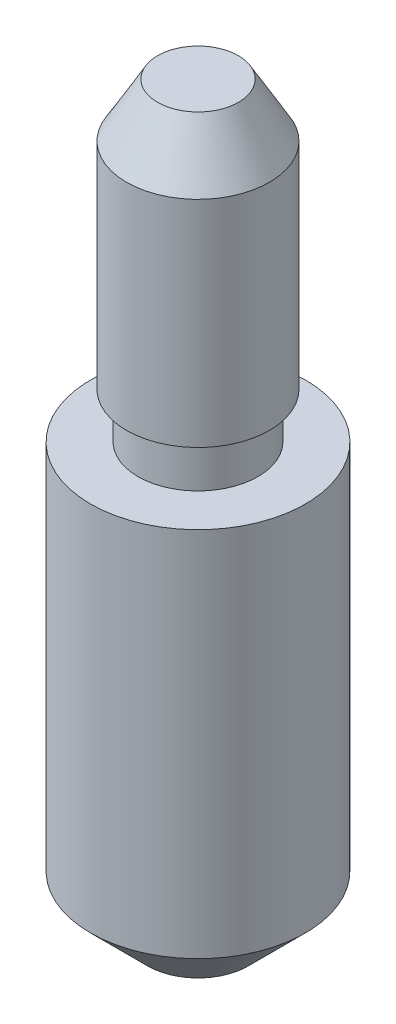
SolidWorks part; units mm, degrees
ref_plane "Front" through (0, 0, 0) normal (0, 0, 1) x (1, 0, 0)
ref_plane "Top" through (0, 0, 0) normal (0, 1, 0) x (1, 0, 0)
ref_plane "Right" through (0, 0, 0) normal (1, 0, 0) x (0, 0, -1)
sketch "Sketch1" plane through (0, 0, 0) normal (1, 0, 0) x (0, 0, -1)
  line L0 (0, 5.5025) -> (0, -11.5809) construction
  line L1 (0, -9.525) -> (2.3876, -9.525)
  line L2 (2.3876, -9.525) -> (2.3876, 0)
  line L3 (2.3876, 0) -> (1.3335, 0)
  line L4 (1.3335, 0) -> (1.3335, 1.016)
  line L5 (1.3335, 1.016) -> (1.5875, 1.016)
  line L6 (1.5875, 1.016) -> (1.5875, 5.7912)
  line L7 (0.8983, 6.985) -> (0, 6.985)
  line L8 (0, 6.985) -> (0, -9.525)
  line L9 (0.8983, 6.985) -> (1.5875, 5.7912)
  dimension "D1" = 4.7752
  dimension "D2" = 9.525
  dimension "D3" = 1.016
  dimension "D4" = 0.254
  dimension "D5" = 3.175
  dimension "D6" = 4.7752
  dimension "D7" = 1.1938
  dimension "D8" = 30
revolve "Revolve1" add sketch "Sketch1" angle 360 about L0
chamfer "Chamfer1" distance 1.27 angle 45 1 edges at (0, -9.525, 2.3876)
sketch "Sketch2" [suppressed] plane through (0, 0, 0) normal (0, 1, 0) x (-1, 0, 0)
  line L0 (-2.3876, 0) -> (0, 1.717)
  line L1 (0, 1.717) -> (2.3876, 0)
  line L2 (2.3876, 0) -> (-2.3876, 0) construction
  line L3 (2.3876, 0) -> (2.3876, 2.5866)
  line L4 (2.3876, 2.5866) -> (-2.3876, 2.5866)
  line L5 (-2.3876, 2.5866) -> (-2.3876, 0)
  circle A0 centre (0, 0) radius 2.3876 construction
  point P3 (0, 0)
extrude "Cut-Extrude3" [suppressed] cut sketch "Sketch2" along normal blind 9.906
mirror "Mirror1" [suppressed] about plane through (0, 0, 0) normal (0, 0, 1)
